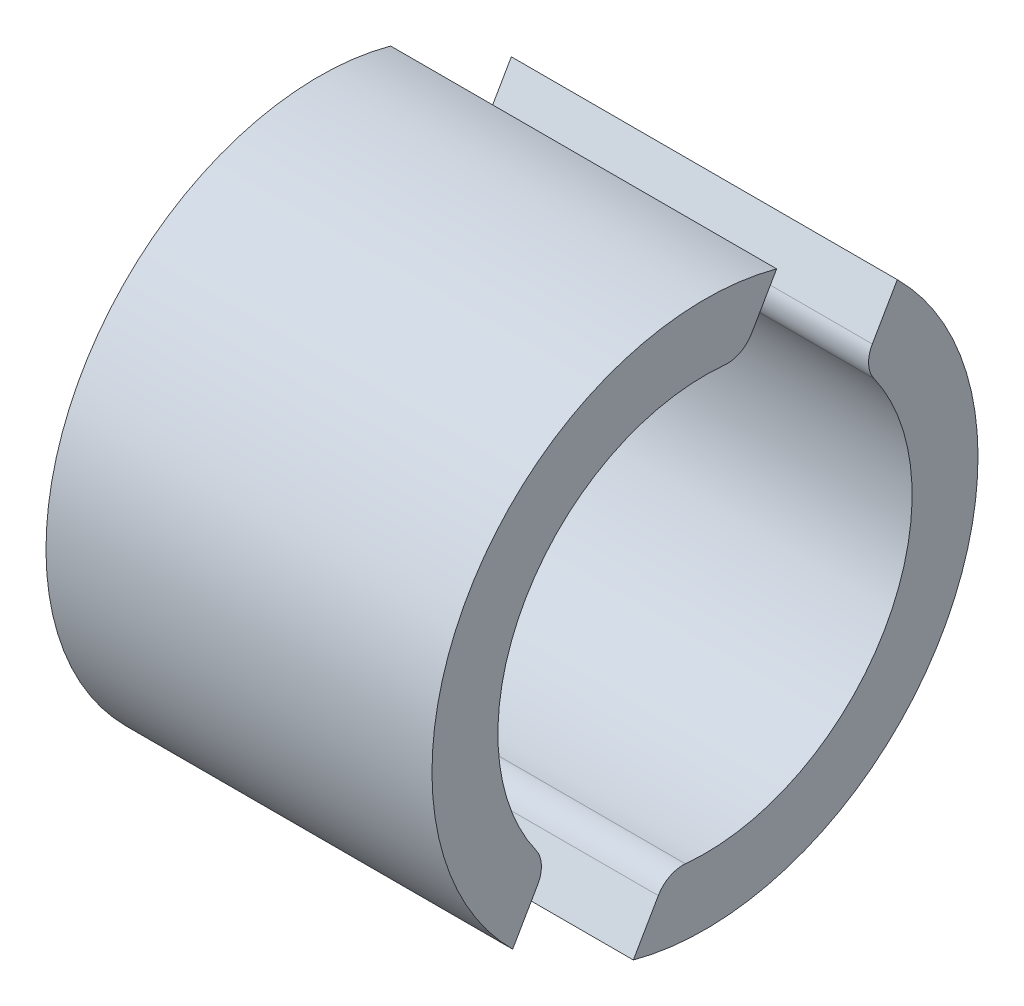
SolidWorks part; units mm, degrees
ref_plane "Face" through (0, 0, 0) normal (0, 0, 1) x (1, 0, 0)
ref_plane "Dessus" through (0, 0, 0) normal (0, 1, 0) x (1, 0, 0)
ref_plane "Droite" through (0, 0, 0) normal (1, 0, 0) x (0, 0, -1)
ref_plane "Plan1" through (47, 0, 0) normal (1, 0, 0) x (0, 0, -1)
sketch "Esquisse3" plane through (47, 0, 0) normal (1, 0, 0) x (0, 0, -1)
  circle A0 centre (0, 0) radius 29 construction
  circle A1 centre (0, 0) radius 29
  circle A2 centre (0, 0) radius 22
  dimension "D1" = 44
extrude "Extrusion1" add sketch "Esquisse3" against normal offset from surface (41 mm away) 6
sketch "Esquisse4" plane through (47, 0, 0) normal (1, 0, 0) x (0, 0, -1)
  line L0 (12.5, 21.6506) -> (-12.5, -21.6506) construction
  line L1 (7.6114, 27.9833) -> (-20.4286, -20.5833)
  line L2 (20.4286, 20.5833) -> (-7.6114, -27.9833)
  circle A0 centre (0, 0) radius 29 construction
  arc A1 (20.4286, 20.5833) -> (7.6114, 27.9833) centre (0, 0) ccw
  arc A2 (-20.4286, -20.5833) -> (-7.6114, -27.9833) centre (0, 0) ccw
  dimension "D1" = 14.8
  dimension "D2" = 7.4
extrude "Enlèv. mat.-Extru.2" cut sketch "Esquisse4" against normal through all
fillet "Congé3" radius 3
fillet "Congé4" radius 3
